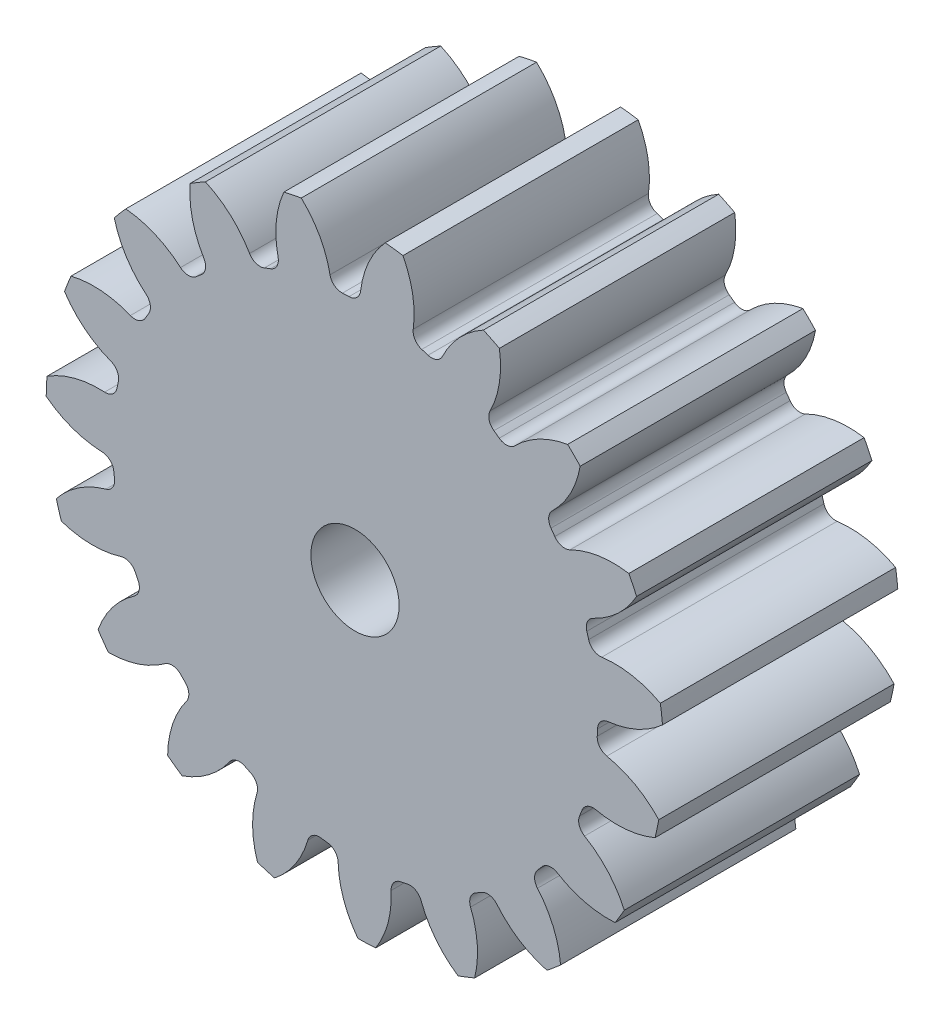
SolidWorks part; units mm, degrees
ref_plane "Front" through (0, 0, 0) normal (0, 0, 1) x (1, 0, 0)
ref_plane "Top" through (0, 0, 0) normal (0, 1, 0) x (1, 0, 0)
ref_plane "Right" through (0, 0, 0) normal (1, 0, 0) x (0, 0, -1)
sketch "Sketch3" plane through (0, 0, 0) normal (0, 0, 1) x (1, 0, 0)
  circle A0 centre (0, 0) radius 133.35
  dimension "od" = 266.7
extrude "gearBody" add sketch "Sketch3" along normal blind 101.6
sketch "Sketch2" plane through (0, 0, 0) normal (0, 0, 1) x (1, 0, 0)
  line L0 (0, 0) -> (104.7438, 43.3863) construction
  line L1 (131.6924, -24.5541) -> (0, 0) construction
  line L2 (0, 0) -> (36.3143, 0) construction
  line L3 (120.5622, 4.6019) -> (119.6804, -15.2653) construction
  line L5 (120.1213, -5.3317) -> (0, 0) construction
  line L7 (0, 0) -> (113.3739, 0) construction
  arc A0 (113.3486, 2.3935) -> (112.6908, -12.4265) centre (0, 0) ccw construction
  arc A1 (132.7842, 12.2705) -> (131.1749, -23.9867) centre (0, 0) ccw construction
  arc A2 (120.5622, 4.6019) -> (119.6804, -15.2653) centre (0, 0) ccw construction
  arc A3 (104.5994, -6.064) -> (104.7253, -3.2272) centre (0, 0) ccw
  arc A4 (131.6924, -24.5541) -> (108.7411, -11.4307) centre (100.488, -52.4958) ccw
  arc A5 (131.6924, -24.5541) -> (133.35, 12.7899) centre (0, 0) ccw
  arc A6 (133.35, 12.7899) -> (109.3263, 1.7515) centre (104.7438, 43.3863) cw
  arc A7 (104.7253, -3.2272) -> (109.3263, 1.7515) centre (109.8917, -3.3864) cw
  arc A8 (108.7411, -11.4307) -> (104.5994, -6.064) centre (109.7596, -6.3631) cw
  point P6 (133.35, 12.7899)
  point P22 (131.6924, -24.5541)
  dimension "baseDia" = 226.7478
  dimension "od" = 266.7
  dimension "pd" = 241.3
  dimension "rd" = 209.55
  dimension "rFillet" = 5.1689
  dimension "pointX" = 133.35
  dimension "pointY" = 12.7899
  dimension "CTT" = 19.8672
  dimension "flankCenterAngle" = 22.5
extrude "toothCut" cut sketch "Sketch2" along normal through all
pattern_circular "CirPattern1" count 19 over 360 about axis through (0, 0, 0) along (0, 0, 1) of "toothCut"
sketch "hub1Dia" plane through (0, 0, 0) normal (0, 0, -1) x (-1, 0, 0)
  circle A0 centre (0, 0) radius 12.7
  dimension "hub1Dia" = 25.4
sketch "hub2Dia" plane through (0, 0, 101.6) normal (0, 0, 1) x (1, 0, 0)
  circle A0 centre (0, 0) radius 12.7
  dimension "hub2dia" = 25.4
sketch "boreDia" plane through (0, 0, 0) normal (0, 0, 1) x (1, 0, 0)
  circle A0 centre (0, 0) radius 19.05
  dimension "boreDia" = 38.1
extrude "bore" cut sketch "boreDia" against normal mid plane 25400
